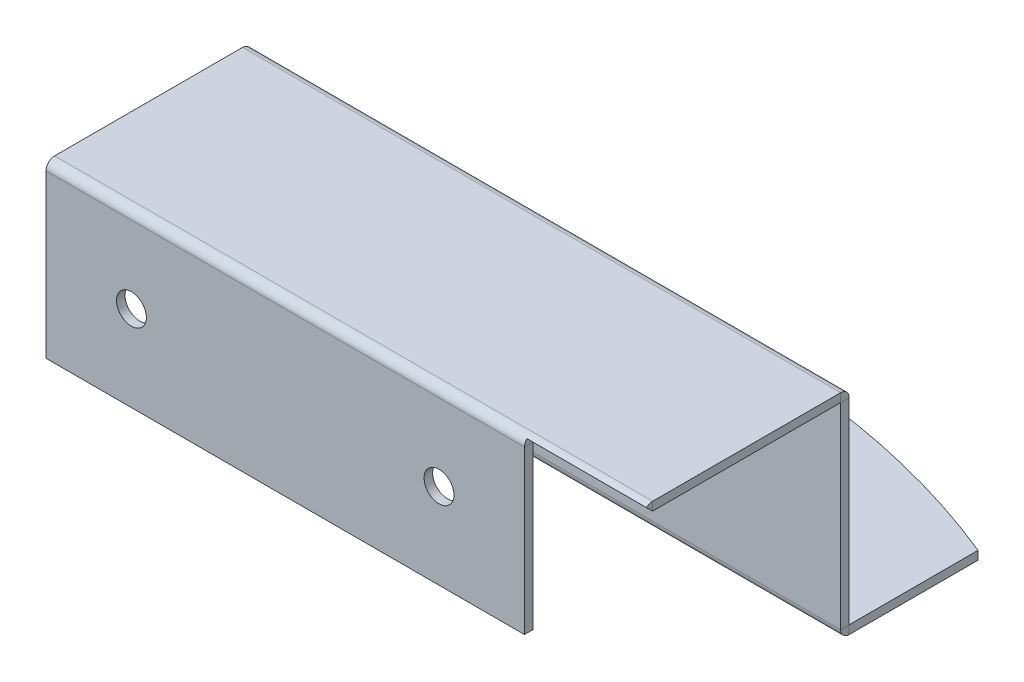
SolidWorks part; units mm, degrees
ref_plane "Front" through (0, 0, 0) normal (0, 0, 1) x (1, 0, 0)
ref_plane "Top" through (0, 0, 0) normal (0, 1, 0) x (1, 0, 0)
ref_plane "Right" through (0, 0, 0) normal (1, 0, 0) x (0, 0, -1)
sketch "Sketch1" plane through (0, 0, 0) normal (0, 1, 0) x (1, 0, 0)
  line L0 (21, 20) -> (21, 0)
  line L1 (35, 20) -> (35, 85.0823)
  line L2 (-35, 0) -> (-35, 85.0823)
  line L6 (-35, 0) -> (21, 0)
  line L11 (21, 20) -> (35, 20)
  circle A0 centre (-25, 10) radius 1.75
  circle A1 centre (11, 10) radius 1.75
  arc A2 (35, 85.0823) -> (-35, 85.0823) centre (0, 0) ccw
sheet metal parameters "Sheet-Metal1" thickness 1 parameters "D1"=0
base flange "Base-Flange1" sketch "Sketch1" thickness 1 reverse thickness direction yes parameters "D1"=0
sketch "Sketch3" plane through (0, 1, 0) normal (0, 1, 0) x (-1, 0, 0)
  line L1 (35, -20) -> (-21, -20)
  line L2 (35, -44) -> (-35, -44)
  line L4 (35, -20) -> (-35, -20) construction
sketched bend "Sketched Bend4" parameters "D1"=0.01
bend "SketchBend3" bend radius 0.01 bend angle 90 parameters "D5"=1
bend "SketchBend4" bend radius 0.01 bend angle 90 parameters "D5"=2
sketch "Sketch4" plane through (0, 1, 0) normal (0, 1, 0) x (-1, 0, 0)
  line L1 (35, -69.01) -> (-35, -69.01)
sketched bend "Sketched Bend5" parameters "D1"=0
bend "SketchBend5" bend radius 0 bend angle 90 parameters "D5"=3
flat pattern "Flat-Pattern1"
sketch "Bend-Lines1" plane through (0, 1, 0) normal (0, 1, 0) x (-1, 0, 0)
  line L0 (-35, -69.015) -> (35, -69.015) construction
  line L1 (-35, -44.005) -> (35, -44.005) construction
  line L2 (-35, -20.005) -> (35, -20.005) construction
bend of the flat pattern "Flatten-<SketchBend3>1"
bend of the flat pattern "Flatten-<SketchBend4>1"
bend of the flat pattern "Flatten-<SketchBend5>1"
